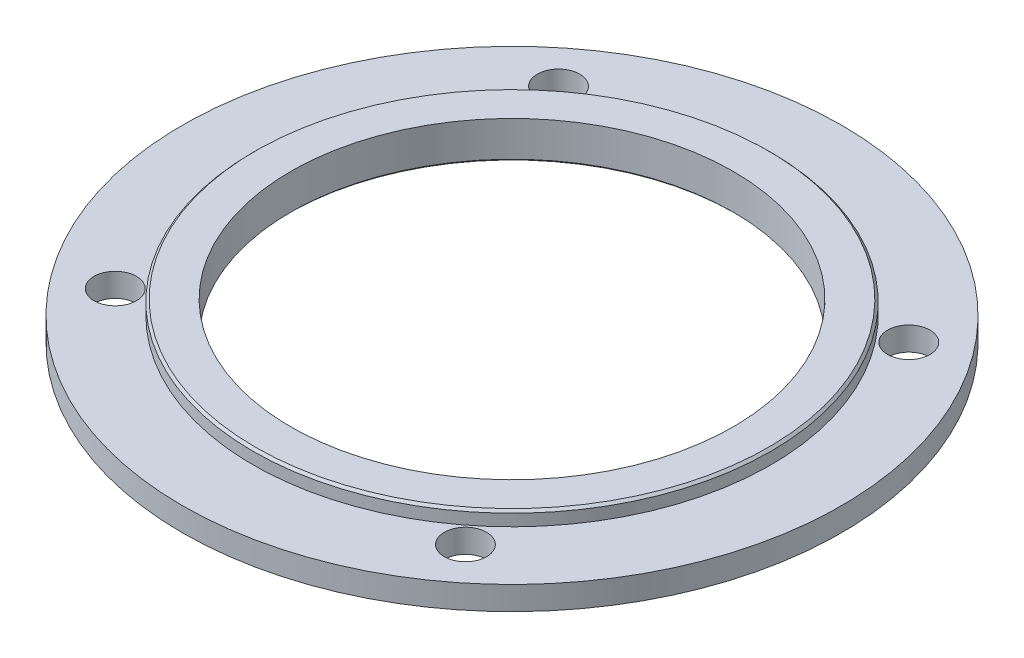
SolidWorks part; units mm, degrees
ref_plane "Face" through (0, 0, 0) normal (0, 0, 1) x (1, 0, 0)
ref_plane "Dessus" through (0, 0, 0) normal (0, 1, 0) x (1, 0, 0)
ref_plane "Droite" through (0, 0, 0) normal (1, 0, 0) x (0, 0, -1)
sketch "Esquisse1" plane through (0, 0, 0) normal (0, 0, 1) x (1, 0, 0)
  line L0 (0, 0) -> (0, 70.8283) construction
  line L1 (47, 0) -> (47, 8)
  line L2 (47, 8) -> (55, 8)
  line L3 (55, 8) -> (55, 5)
  line L4 (55, 5) -> (70, 5)
  line L5 (70, 5) -> (70, 0)
  line L6 (70, 0) -> (47, 0)
  dimension "D1" = 140
  dimension "D2" = 94
  dimension "D3" = 110
  dimension "D4" = 3
  dimension "D5" = 5
revolve "Révolution1" add sketch "Esquisse1" angle 360 about L0
chamfer "Chanfrein1" distance 0.5 angle 45
hole_wizard "Dégagement M81" positions "Esquisse3" profile "Esquisse2" hole size "M8" standard "Ansi Métrique"
sketch "Esquisse3" plane through (0, 0, 0) normal (0, -1, 0) x (1, 0, 0)
  circle A0 centre (-47.0797, 37.1955) radius 4.5 construction
  point P0 (-47.0797, 37.1955)
  point P1 (37.1955, 47.0797)
  point P2 (47.0797, -37.1955)
  point P4 (-37.1955, -47.0797)
sketch "Esquisse2" plane through (-47.0797, 0, 37.1955) normal (1, 0, 0) x (0, 0, -1)
  line L0 (0, 0) -> (0, 8)
  line L1 (0, 8) -> (4.5, 8)
  line L2 (4.5, 8) -> (4.5, 0)
  line L5 (4.5, 0) -> (0, 0)
  line L11 (0, -6.35) -> (0, 107.95) construction
  dimension "Diamètre du perçage jusqu'au prochain" = 9
  dimension "Profondeur du perçage jusqu'au prochain" = 8
